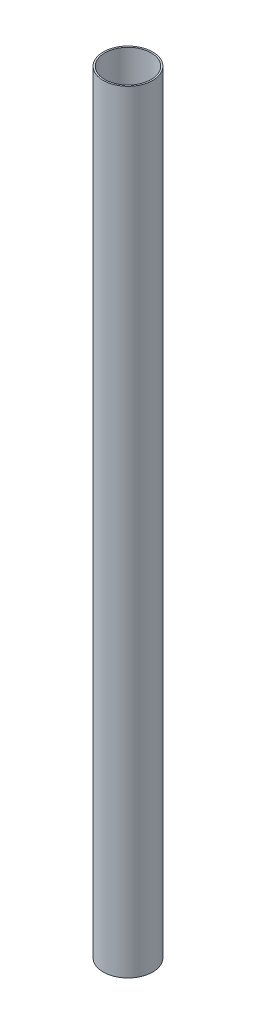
SolidWorks part; units mm, degrees
ref_plane "Front Plane" through (0, 0, 0) normal (0, 0, 1) x (1, 0, 0)
ref_plane "Top Plane" through (0, 0, 0) normal (0, 1, 0) x (1, 0, 0)
ref_plane "Right Plane" through (0, 0, 0) normal (1, 0, 0) x (0, 0, -1)
sketch "Sketch1" plane through (0, 0, 0) normal (0, 1, 0) x (1, 0, 0)
  circle A0 centre (0, 0) radius 7.5
  circle A1 centre (0, 0) radius 8
  dimension "D1" = 16
  dimension "D2" = 15
extrude "Boss-Extrude1" add sketch "Sketch1" along normal blind 250
